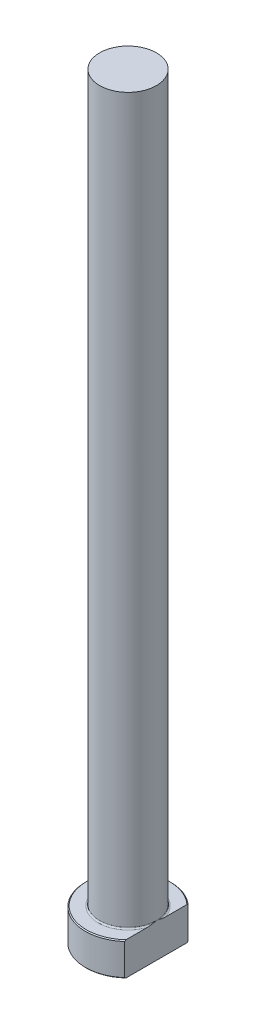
SolidWorks part; units mm, degrees
ref_plane "Front Plane" through (0, 0, 0) normal (0, 0, 1) x (1, 0, 0)
ref_plane "Top Plane" through (0, 0, 0) normal (0, 1, 0) x (1, 0, 0)
ref_plane "Right Plane" through (0, 0, 0) normal (1, 0, 0) x (0, 0, -1)
sketch "Sketch1" plane through (0, 0, 0) normal (0, 0, 1) x (1, 0, 0)
  line L0 (0, 259.9588) -> (0, -15.1925) construction
  line L1 (0, 0) -> (-9, 0)
  line L2 (-9, 0) -> (-9, 7)
  line L3 (-9, 7) -> (-6, 7)
  line L4 (-6, 7) -> (-6, 160)
  line L5 (-6, 160) -> (0, 160)
  line L6 (0, 160) -> (0, 0)
  dimension "L" = 160
  dimension "H" = 18
  dimension "T" = 7
  dimension "D" = 12
revolve "Revolve1" add sketch "Sketch1" angle 360 about L0
chamfer "Chamfer1" distance 0.2 angle 45 2 edges at (0, 7, 9) (0, 0, 9)
fillet "Fillet1" radius 0.3 1 edges at (0, 7, 6)
sketch "Sketch2" plane through (0, 0, 0) normal (0, 1, 0) x (1, 0, 0)
  line L0 (6, 6.7082) -> (6, -6.7082)
  circle A0 centre (0, 0) radius 9 construction
  arc A1 (6, -6.7082) -> (6, 6.7082) centre (0, 0) ccw
  circle A2 centre (0, 0) radius 6 construction
extrude "KEY" cut sketch "Sketch2" along normal through all
